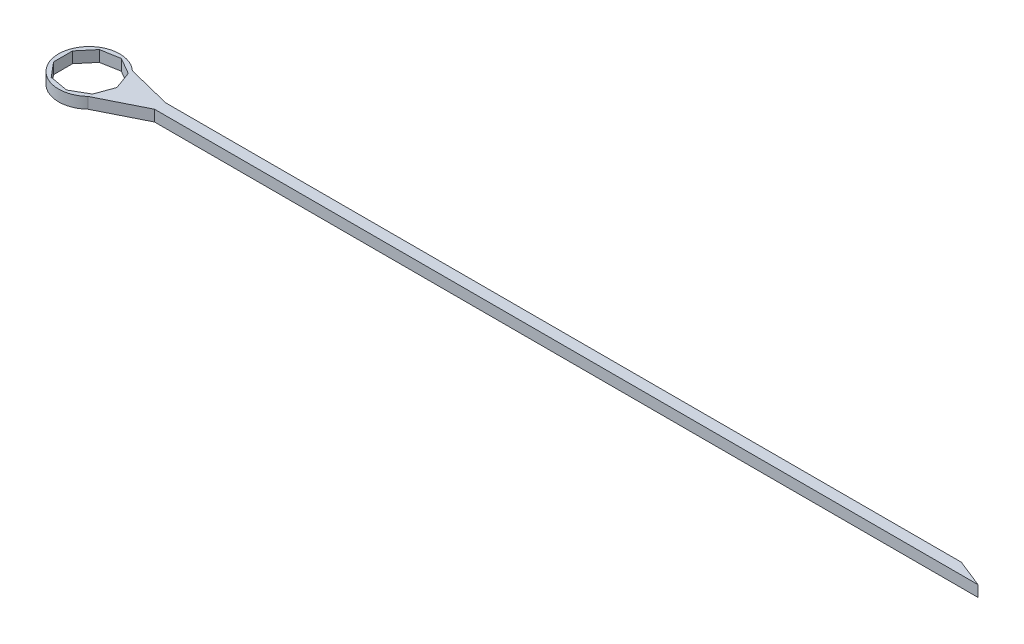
SolidWorks part; units mm, degrees
ref_plane "Front Plane" through (0, 0, 0) normal (0, 0, 1) x (1, 0, 0)
ref_plane "Top Plane" through (0, 0, 0) normal (0, 1, 0) x (1, 0, 0)
ref_plane "Right Plane" through (0, 0, 0) normal (1, 0, 0) x (0, 0, -1)
sketch "Sketch1" plane through (0, 0, 0) normal (0, 1, 0) x (1, 0, 0)
  line L0 (5.8875, 0) -> (80, 0)
  line L1 (2.5, 0) -> (1.9151, 1.607)
  line L2 (1.9151, 1.607) -> (0.4341, 2.462)
  line L3 (0.4341, 2.462) -> (-1.25, 2.1651)
  line L4 (-1.25, 2.1651) -> (-2.3492, 0.8551)
  line L5 (-2.3492, 0.8551) -> (-2.3492, -0.8551)
  line L6 (-2.3492, -0.8551) -> (-1.25, -2.1651)
  line L7 (-1.25, -2.1651) -> (0.4341, -2.462)
  line L8 (0.4341, -2.462) -> (1.9151, -1.607)
  line L9 (1.9151, -1.607) -> (2.5, 0)
  line L10 (80, 0) -> (77.5, 1)
  line L11 (77.5, 1) -> (5.8875, 1)
  line L12 (5.8875, 1) -> (1.8875, 2)
  line L13 (5.8875, 0) -> (1.8875, -2)
  arc A0 (1.8875, 2) -> (1.8875, -2) centre (0, 0) ccw
  circle A1 centre (0, 0) radius 2.5 construction
  dimension "D1" = 5.5
  dimension "D2" = 5
  dimension "D3" = 1
  dimension "D4" = 2.5
  dimension "D5" = 2
  dimension "D6" = 4
  dimension "D7" = 80
  dimension "D8" = 2
extrude "Boss-Extrude1" add sketch "Sketch1" along normal blind 1
sketch "Sketch2" plane through (0, 1, 0) normal (0, 1, 0) x (1, 0, 0)
  line L0 (0, 0) -> (16, 0)
  line L1 (5.8875, 0) -> (80, 0) construction
  line L2 (16, 0) -> (23.6429, 0)
  line L3 (23.6429, 0) -> (31.2857, 0)
  line L4 (31.2857, 0) -> (38.9286, 0)
  line L5 (38.9286, 0) -> (46.5714, 0)
  line L6 (46.5714, 0) -> (54.2143, 0)
  line L7 (54.2143, 0) -> (61.8571, 0)
  line L8 (61.8571, 0) -> (69.5, 0)
  line L10 (69.5, 0) -> (77.5, 0)
  dimension "D1" = 16
  dimension "D2" = 8
